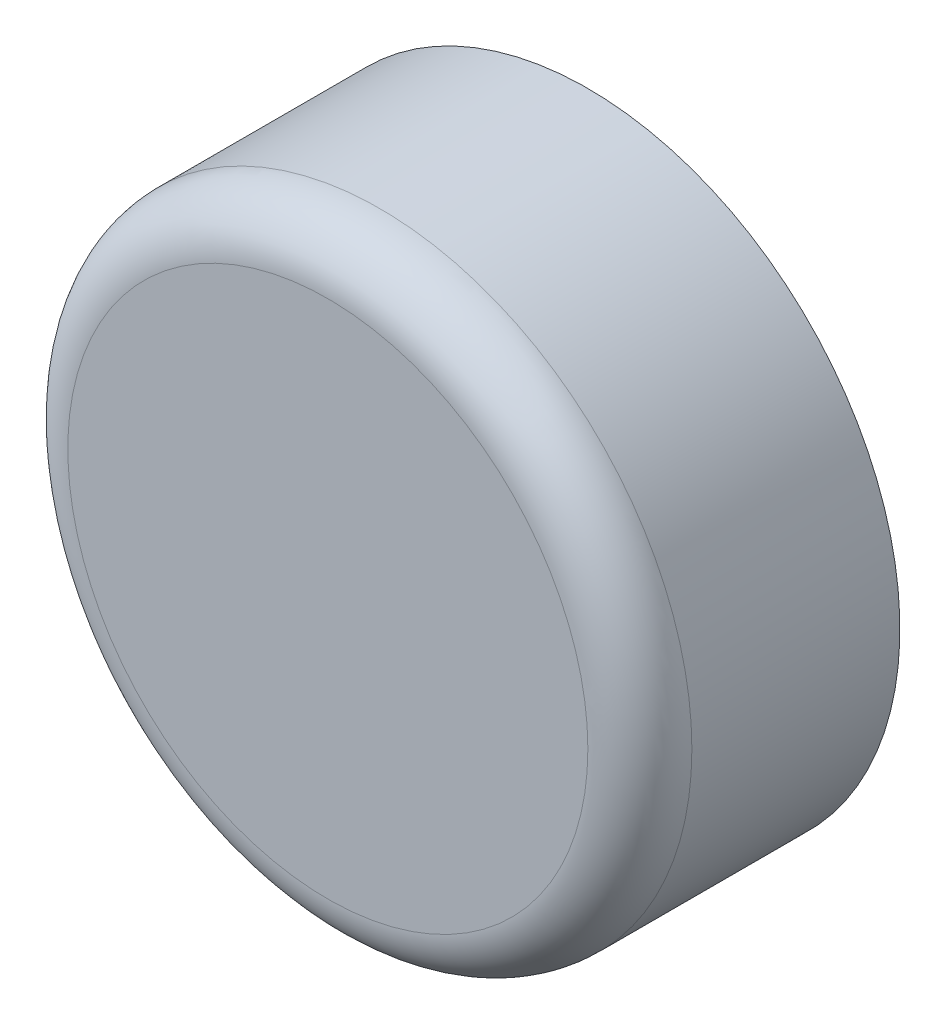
SolidWorks part; units mm, degrees
ref_plane "Přední rovina" through (0, 0, 0) normal (0, 0, 1) x (1, 0, 0)
ref_plane "Horní rovina" through (0, 0, 0) normal (0, 1, 0) x (1, 0, 0)
ref_plane "Pravá rovina" through (0, 0, 0) normal (1, 0, 0) x (0, 0, -1)
sketch "Skica1" plane through (0, 0, 0) normal (0, 0, 1) x (1, 0, 0)
  circle A1 centre (0, 0) radius 30
  dimension "D2" = 60
extrude "Přidat vysunutím1" add sketch "Skica1" along normal blind 5
sketch "Skica2" plane through (0, 0, 0) normal (1, 0, 0) x (0, 0, -1)
  line L0 (0, 0) -> (0, 10)
  line L1 (0, 0) -> (-2.5, 0)
  arc A0 (-2.5, 0) -> (0, 10) centre (18.75, 0) cw
  dimension "D2" = 10
  dimension "D1" = 2.5
revolve "Odebrat rotací1" cut sketch "Skica2" angle 360 about L1
sketch "Skica3" plane through (0, 0, 0) normal (0, 0, -1) x (-1, 0, 0)
  circle A0 centre (0, 0) radius 30
  circle A1 centre (0, 0) radius 30
extrude "Přidat vysunutím2" add sketch "Skica3" along normal blind 20 contours M2 M1
sketch "Skica11" plane through (0, 0, 0) normal (1, 0, 0) x (0, 0, -1)
  line L0 (0, 0) -> (7.5, 0) construction
  circle A0 centre (7.5, 0) radius 5
  dimension "D2" = 10
  dimension "D1" = 7.5
extrude "Odebrat vysunutím1" cut sketch "Skica11" against normal blind 53
fillet "Zaoblit1" radius 5 1 edges at (30, 0, 5)
scale "Měřítko1" scale about centroid uniform scaling yes scale factor 0.655
